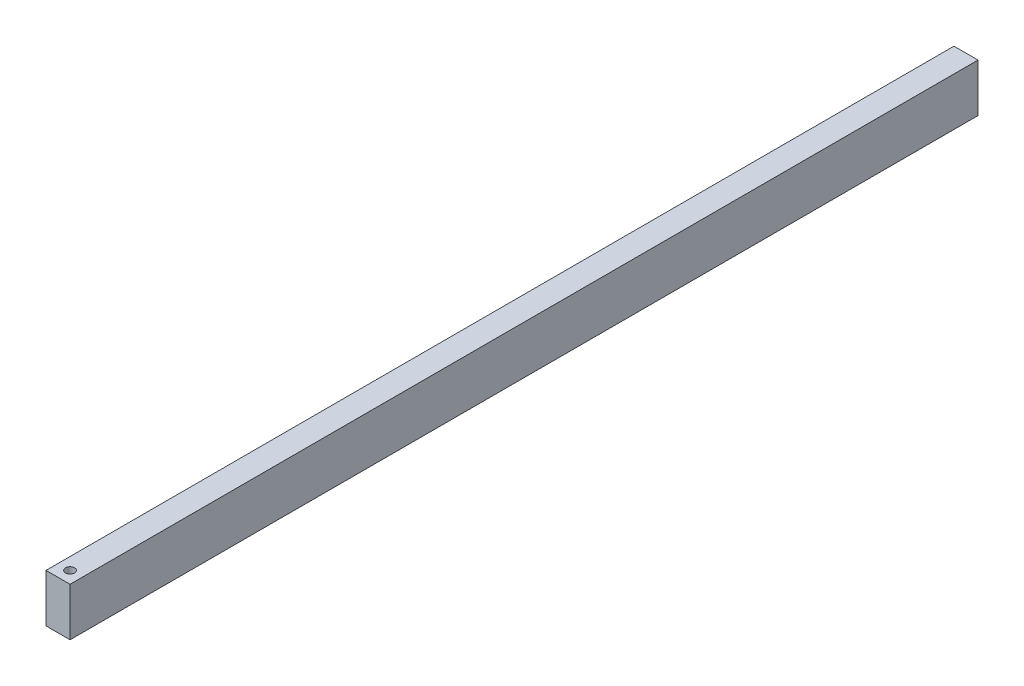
SolidWorks part; units mm, degrees
ref_plane "Front Plane" through (0, 0, 0) normal (0, 0, 1) x (1, 0, 0)
ref_plane "Top Plane" through (0, 0, 0) normal (0, 1, 0) x (1, 0, 0)
ref_plane "Right Plane" through (0, 0, 0) normal (1, 0, 0) x (0, 0, -1)
sketch "Sketch1" plane through (0, 0, 0) normal (0, 0, 1) x (1, 0, 0)
  line L1 (0, 0) -> (50.8, 0)
  line L2 (0, 0) -> (0, 101.6)
  line L3 (0, 101.6) -> (50.8, 101.6)
  line L4 (50.8, 0) -> (50.8, 101.6)
  dimension "D1" = 50.8
  dimension "D2" = 101.6
extrude "Boss-Extrude1" add sketch "Sketch1" along normal blind 1917.7
sketch "Sketch2" plane through (0, 101.6, 0) normal (0, 1, 0) x (1, 0, 0)
  line L0 (25.4, -1917.7) -> (25.4, -1800.9084) construction
  line L1 (50.8, -1917.7) -> (0, -1917.7) construction
  circle A0 centre (25.4, -1892.3) radius 9.525
  dimension "D1" = 19.05
  dimension "D2" = 25.4
extrude "Cut-Extrude1" cut sketch "Sketch2" against normal blind 76.2
